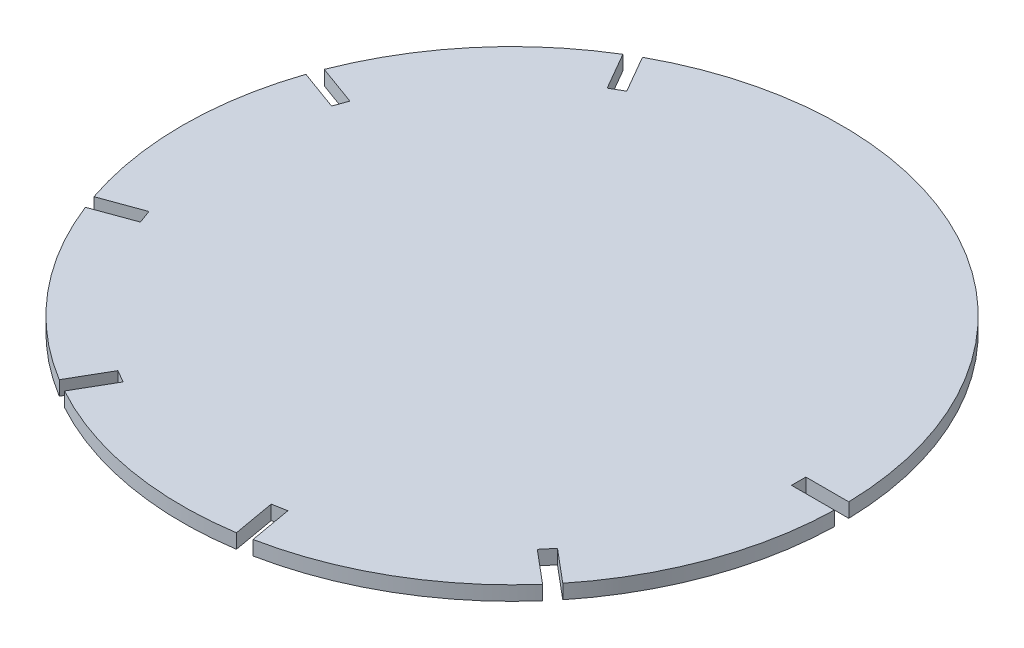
SolidWorks part; units mm, degrees
ref_plane "Front Plane" through (0, 0, 0) normal (0, 0, 1) x (1, 0, 0)
ref_plane "Top Plane" through (0, 0, 0) normal (0, 1, 0) x (1, 0, 0)
ref_plane "Right Plane" through (0, 0, 0) normal (1, 0, 0) x (0, 0, -1)
sketch "Sketch1" plane through (0, 0, 0) normal (0, 1, 0) x (1, 0, 0)
  circle A0 centre (0, 0) radius 345
  dimension "D1" = 345
extrude "Boss-Extrude1" add sketch "Sketch1" along normal blind 15 contours A0
sketch "Sketch2" plane through (0, 15, 0) normal (0, 1, 0) x (1, 0, 0)
  line L0 (0, 0) -> (345, 0) construction
  line L2 (300, 7.5) -> (405, 7.5)
  line L3 (300, 7.5) -> (300, -7.5)
  line L4 (300, -7.5) -> (405, -7.5)
  line L5 (405, 7.5) -> (405, -7.5)
  line L9 (59.4805, -294.14) -> (77.7136, -397.5448)
  line L10 (59.4805, -294.14) -> (44.7084, -296.7447)
  line L11 (44.7084, -296.7447) -> (62.9415, -400.1495)
  line L12 (77.7136, -397.5448) -> (62.9415, -400.1495)
  line L16 (234.6342, -187.0909) -> (315.0689, -254.5836)
  line L17 (234.6342, -187.0909) -> (224.9924, -198.5816)
  line L18 (224.9924, -198.5816) -> (305.4271, -266.0743)
  line L19 (315.0689, -254.5836) -> (305.4271, -266.0743)
  line L22 (0, 0) -> (59.9086, -339.7587) construction
  line L24 (-143.5048, -263.5576) -> (-196.0048, -354.4903)
  line L25 (-143.5048, -263.5576) -> (-156.4952, -256.0576)
  line L26 (-156.4952, -256.0576) -> (-208.9952, -346.9903)
  line L27 (-196.0048, -354.4903) -> (-208.9952, -346.9903)
  line L29 (0, 0) -> (264.2853, -221.7617) construction
  line L31 (0, 0) -> (-172.5, -298.7788) construction
  line L33 (-279.3426, -109.6537) -> (-378.0104, -145.5659)
  line L34 (-279.3426, -109.6537) -> (-284.4729, -95.5583)
  line L35 (-284.4729, -95.5583) -> (-383.1407, -131.4705)
  line L36 (-378.0104, -145.5659) -> (-383.1407, -131.4705)
  line L39 (0, 0) -> (-324.194, -117.9969) construction
  line L41 (-284.4729, 95.5583) -> (-383.1407, 131.4705)
  line L42 (-284.4729, 95.5583) -> (-279.3426, 109.6537)
  line L43 (-279.3426, 109.6537) -> (-378.0104, 145.5659)
  line L44 (-383.1407, 131.4705) -> (-378.0104, 145.5659)
  line L47 (0, 0) -> (-324.194, 117.9969) construction
  line L55 (-156.4952, 256.0576) -> (-208.9952, 346.9903)
  line L56 (-156.4952, 256.0576) -> (-143.5048, 263.5576)
  line L57 (-143.5048, 263.5576) -> (-196.0048, 354.4903)
  line L58 (-208.9952, 346.9903) -> (-196.0048, 354.4903)
  line L61 (0, 0) -> (-172.5, 298.7788) construction
  circle A0 centre (0, 0) radius 345 construction
  point P23 (0, 0)
extrude "Cut-Extrude3" cut sketch "Sketch2" against normal blind 15
equation "\"Inner Circle\"= 350mm"
equation "\"D1@Sketch2\"= 100 + \"CutExtrude Clearing\""
equation "\"CutExtrude Clearing\"= 5mm"
